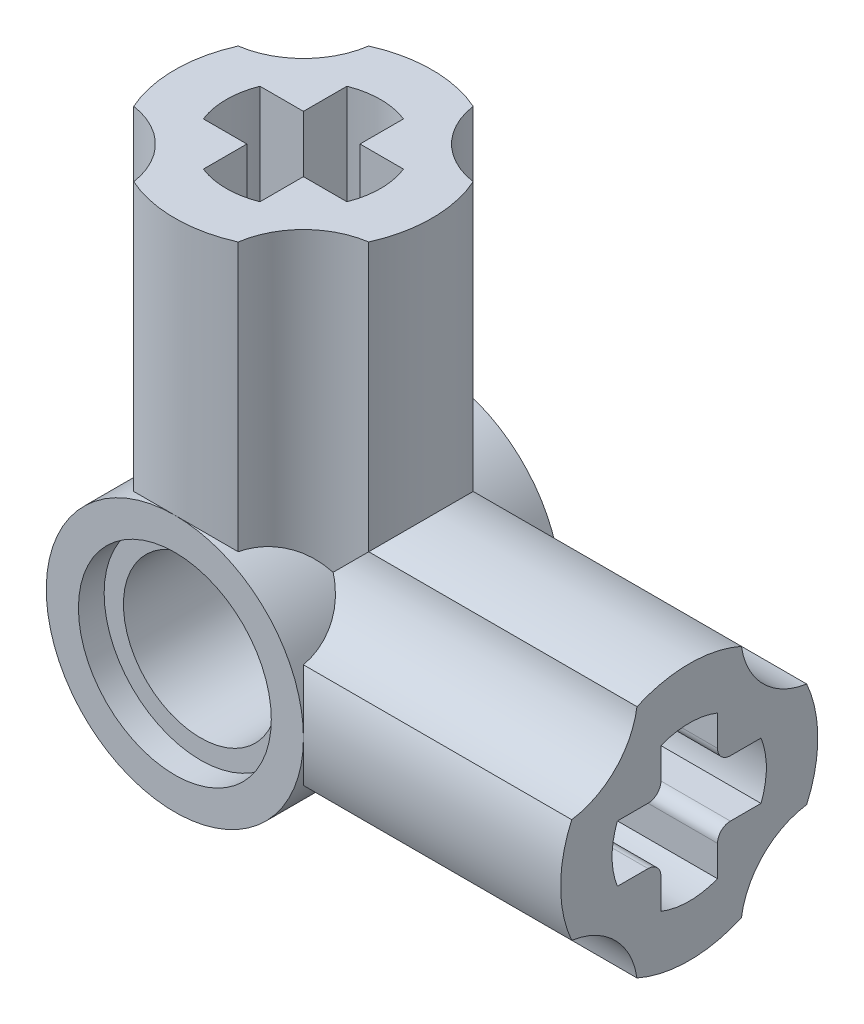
SolidWorks part; units mm, degrees
ref_plane "정면" through (0, 0, 0) normal (0, 0, 1) x (1, 0, 0)
ref_plane "윗면" through (0, 0, 0) normal (0, 1, 0) x (1, 0, 0)
ref_plane "우측면" through (0, 0, 0) normal (1, 0, 0) x (0, 0, -1)
sketch "스케치1" plane through (0, 0, 0) normal (0, 1, 0) x (1, 0, 0)
  line L0 (-8, 4) -> (-12, 4)
  line L1 (-12, 4) -> (-12, -4)
  line L2 (-12, -4) -> (-8, -4)
  line L3 (-8, -4) -> (-8, 4)
  line L4 (-12, 4) -> (-12, -4) construction
revolve "회전1" add sketch "스케치1" angle 360 about L4
sketch "스케치2" plane through (0, 0, 0) normal (1, 0, 0) x (0, 0, -1)
  arc A0 (-1.6249, -3.6551) -> (1.6249, -3.6551) centre (0, 0) ccw
  arc A1 (1.6249, -3.6551) -> (3.6551, -1.6249) centre (4, -4) cw
  arc A2 (3.6551, -1.6249) -> (3.6551, 1.6249) centre (0, 0) ccw
  arc A3 (3.6551, 1.6249) -> (1.6249, 3.6551) centre (4, 4) cw
  arc A4 (1.6249, 3.6551) -> (-1.6249, 3.6551) centre (0, 0) ccw
  arc A5 (-1.6249, 3.6551) -> (-3.6551, 1.6249) centre (-4, 4) cw
  arc A6 (-3.6551, 1.6249) -> (-3.6551, -1.6249) centre (0, 0) ccw
  arc A7 (-3.6551, -1.6249) -> (-1.6249, -3.6551) centre (-4, -4) cw
extrude "보스-돌출1" add sketch "스케치2" against normal up to next
imported_body "곡면-불러온 피처1"
sketch "스케치3" plane through (0, 0, 0) normal (1, 0, 0) x (0, 0, -1)
  line L0 (-0.88, 2.2328) -> (-0.88, 0.88)
  line L1 (-0.88, 0.88) -> (-2.2328, 0.88)
  line L2 (-2.2328, -0.88) -> (-0.88, -0.88)
  line L3 (-0.88, -0.88) -> (-0.88, -2.2328)
  line L4 (0.88, -2.2328) -> (0.88, -0.88)
  line L5 (0.88, -0.88) -> (2.2328, -0.88)
  line L6 (2.2328, 0.88) -> (0.88, 0.88)
  line L7 (0.88, 0.88) -> (0.88, 2.2328)
  arc A0 (-2.2328, 0.88) -> (-2.2328, -0.88) centre (0, 0) ccw
  arc A1 (-0.88, -2.2328) -> (0.88, -2.2328) centre (0, 0) ccw
  arc A2 (2.2328, -0.88) -> (2.2328, 0.88) centre (0, 0) ccw
  arc A3 (0.88, 2.2328) -> (-0.88, 2.2328) centre (0, 0) ccw
extrude "컷-돌출1" cut sketch "스케치3" against normal up to surface
sketch "스케치4" plane through (0, 0, 0) normal (0, 1, 0) x (1, 0, 0)
  line L0 (-9, 4) -> (-12, 4)
  line L1 (-12, 4) -> (-12, -4)
  line L2 (-12, -4) -> (-9, -4)
  line L3 (-9, -4) -> (-9, -3.2)
  line L4 (-9, -3.2) -> (-9.6, -3.2)
  line L5 (-9.6, -3.2) -> (-9.6, 3.2)
  line L6 (-9.6, 3.2) -> (-9, 3.2)
  line L7 (-9, 3.2) -> (-9, 4)
  line L8 (-12, 4) -> (-12, -4) construction
revolve "컷-회전1" cut sketch "스케치4" angle 360 about L8
fillet "필렛1" radius 0.4 4 edges at (-4.049, 0.88, 0.88) (-4.049, 0.88, -0.88) (-4.049, -0.88, -0.88) (-4.049, -0.88, 0.88)
pattern_circular "원형 패턴1" count 2 every 90 about axis through (-12, 0, 0) along (0, 0, 1) of "보스-돌출1", "컷-돌출1"
